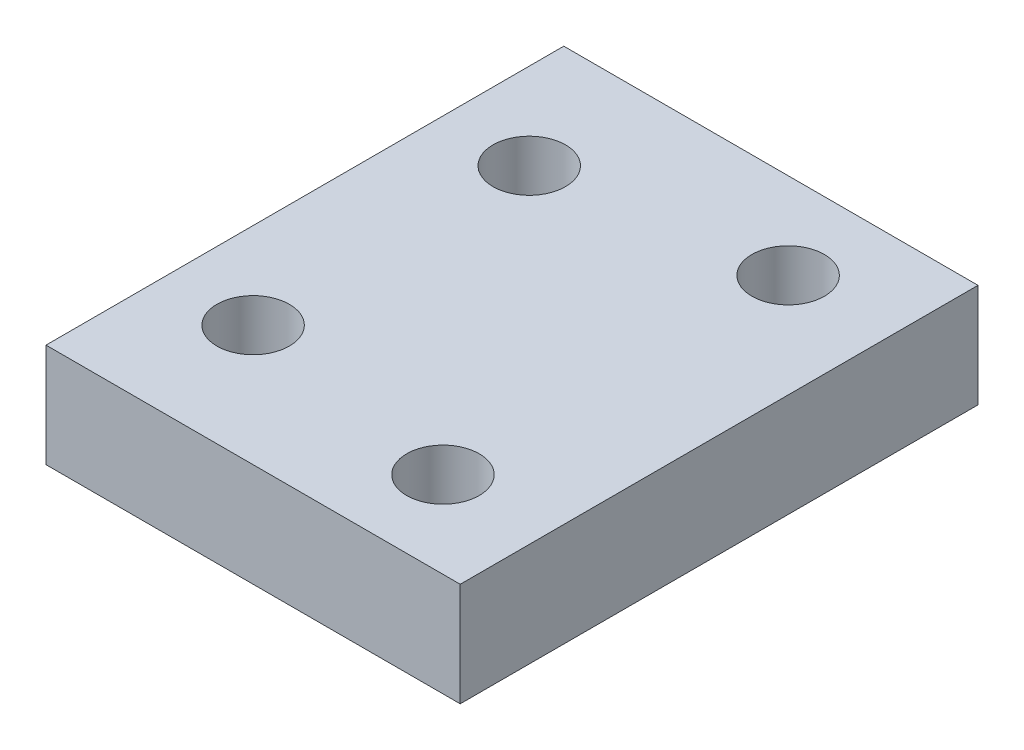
SolidWorks part; units mm, degrees
ref_plane "Спереди" through (0, 0, 0) normal (0, 0, 1) x (1, 0, 0)
ref_plane "Сверху" through (0, 0, 0) normal (0, 1, 0) x (1, 0, 0)
ref_plane "Справа" through (0, 0, 0) normal (1, 0, 0) x (0, 0, -1)
sketch "Эскиз1" plane through (0, 0, 0) normal (0, 1, 0) x (1, 0, 0)
  line L1 (0, 0) -> (-24, 0)
  line L2 (0, 0) -> (0, -30)
  line L3 (0, -30) -> (-24, -30)
  line L4 (-24, 0) -> (-24, -30)
  circle A0 centre (-6, -25) radius 2.1
  circle A1 centre (-6, -5) radius 2.1
  circle A2 centre (-19, -7) radius 2.1
  circle A3 centre (-19, -23) radius 2.1
  dimension "D1" = 4.2
  dimension "D2" = 20
  dimension "D3" = 5
  dimension "D4" = 5
  dimension "D5" = 6
  dimension "D6" = 18
  dimension "D7" = 7
  dimension "D8" = 7
  dimension "D9" = 5
extrude "Бобышка-Вытянуть1" add sketch "Эскиз1" along normal blind 6
